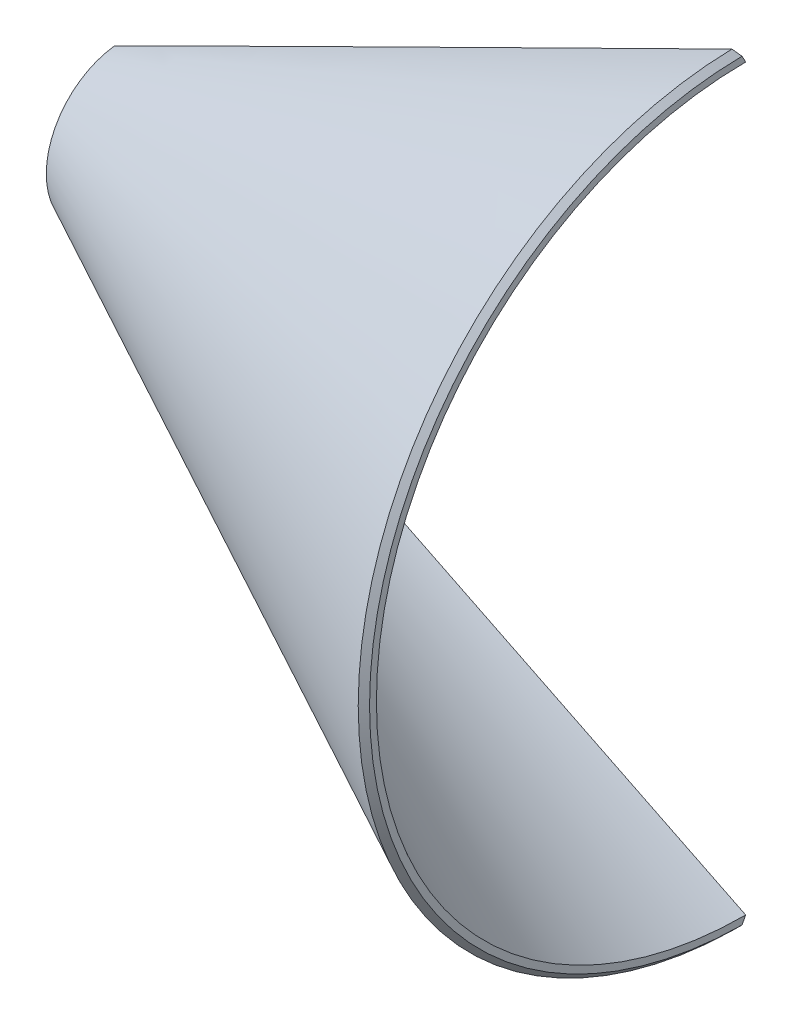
SolidWorks part; units mm, degrees
ref_plane "Ebene vorne" through (0, 0, 0) normal (0, 0, 1) x (1, 0, 0)
ref_plane "Ebene oben" through (0, 0, 0) normal (0, 1, 0) x (1, 0, 0)
ref_plane "Ebene rechts" through (0, 0, 0) normal (1, 0, 0) x (0, 0, -1)
sketch "Skizze1" plane through (0, 0, 0) normal (0, 0, 1) x (1, 0, 0)
  line L0 (0, 0) -> (89.4175, 0) construction
  line L1 (0, 107.5) -> (0, 109.5)
  line L2 (0, 109.5) -> (-1.6476, 111.1476)
  line L3 (-1.6476, 111.1476) -> (-181.0829, 22.5)
  line L4 (-181.0829, 22.5) -> (-179.3111, 18.9138)
  line L5 (-179.3111, 18.9138) -> (0, 107.5)
  dimension "D1" = 107.5
  dimension "D2" = 200
  dimension "D3" = 4
  dimension "D4" = 22.5
  dimension "D5" = 2
  dimension "D6" = 135
revolve "Rotation1" add sketch "Skizze1" angle 180 about L0
chamfer "Fase1" distance 4 angle 30 2 edges at (-91.3652, -66.8238, 0) (-91.3652, 66.8238, 0)
